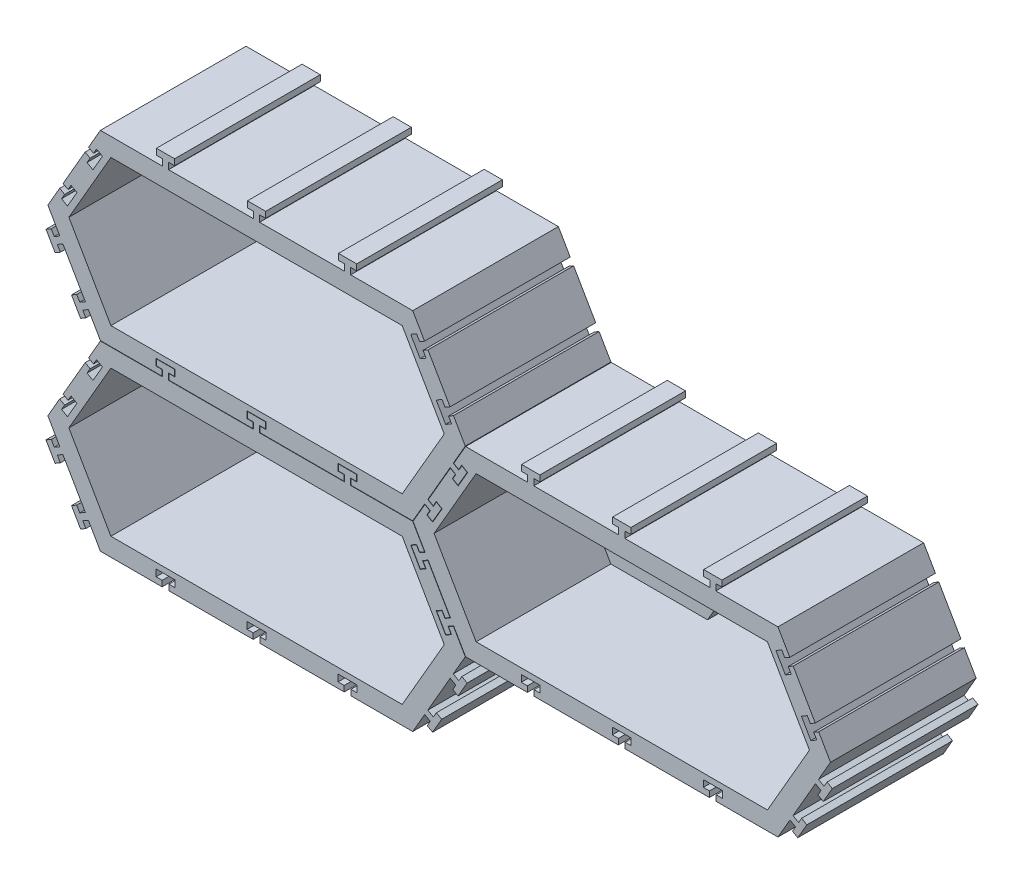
SolidWorks part; units mm, degrees
ref_plane "Front Plane" through (0, 0, 0) normal (0, 0, 1) x (1, 0, 0)
ref_plane "Top Plane" through (0, 0, 0) normal (0, 1, 0) x (1, 0, 0)
ref_plane "Right Plane" through (0, 0, 0) normal (1, 0, 0) x (0, 0, -1)
sketch "Sketch1" plane through (0, 0, 0) normal (0, 0, 1) x (1, 0, 0)
  line L0 (-40, 20) -> (40, -20) construction
  line L7 (51.547, 0) -> (40, 20)
  line L8 (40, 20) -> (-40, 20)
  line L9 (-40, 20) -> (-51.547, 0)
  line L10 (-51.547, 0) -> (-40, -20)
  line L11 (-40, -20) -> (40, -20)
  line L12 (40, -20) -> (51.547, 0)
extrude "Extrude-Thin1" add sketch "Sketch1" along normal blind 40 thin
sketch "Sketch2" plane through (0, 0, 0) normal (0, 0, 1) x (1, 0, 0)
  line L0 (-25, 25) -> (-25, 27.6)
  line L1 (42.8868, 25) -> (-42.8868, 25) construction
  line L2 (-27.5, 27.6) -> (-22.5, 27.6)
  line L3 (-53.6036, -6.4378) -> (-55.8553, -7.7378)
  line L4 (-57.3205, 0) -> (-42.8868, -25) construction
  line L5 (-50.1036, -12.5) -> (-52.3553, -13.8) construction
  line L6 (-57.1053, -5.5728) -> (-54.6053, -9.9029)
  line L7 (-47.6053, -22.0272) -> (-50.1053, -17.6971)
  line L8 (-46.6036, -18.5622) -> (-48.8553, -19.8622)
  line L9 (-50.1036, -12.5) -> (-53.6036, -6.4378) construction
  line L10 (0, 25) -> (0, 27.6)
  line L11 (0, 27.6) -> (-2.5, 27.6)
extrude "Extrude-Thin2" add sketch "Sketch2" along normal through all thin
mirror "Mirror1" about plane through (0, 0, 0) normal (1, 0, 0) of "Extrude-Thin2"
sketch "Sketch3" plane through (0, 0, 0) normal (0, 0, 1) x (1, 0, 0)
  line L0 (-25, -25) -> (-25, -22.5)
  line L1 (-42.8868, -25) -> (42.8868, -25) construction
  line L2 (-27.6, -22.5) -> (-22.4, -22.5)
  line L3 (-53.6036, 6.4378) -> (-51.4386, 5.1878)
  line L4 (-42.8868, 25) -> (-57.3205, 0) construction
  line L5 (-52.7386, 2.9362) -> (-50.1386, 7.4395)
  line L6 (-50.1036, 12.5) -> (-47.9386, 11.25) construction
  line L7 (-53.6036, 6.4378) -> (-50.1036, 12.5) construction
  line L8 (-50.1036, -12.5) -> (-53.6036, -6.4378) construction
  line L11 (-25, 25) -> (-25, 27.6) construction
  line L13 (-46.6036, 18.5622) -> (-44.4386, 17.3122)
  line L14 (-43.1386, 19.5638) -> (-45.7386, 15.0605)
  line L15 (0, -25) -> (0, -22.5)
  line L16 (0, -22.5) -> (-2.6, -22.5)
extrude "Cut-Extrude-Thin1" cut sketch "Sketch3" along normal through all thin
mirror "Mirror2" about plane through (0, 0, 0) normal (1, 0, 0) of "Cut-Extrude-Thin1"
pattern_linear "LPattern1" count 2 spacing 50.1 along (0, 1, 0)
sketch "Sketch5" plane through (0, 0, 0) normal (0, 0, 1) x (1, 0, 0)
  line L0 (-57.827, -5.9894) -> (-53.8836, -9.4862) construction
  line L1 (44.9303, 14.5938) -> (43.9469, 20.0305) construction
  point P4 (-55.8553, -7.7378)
  point P9 (44.4386, 17.3122)
pattern_sketch "Sketch-Pattern1"
sketch "Sketch6" plane through (0, 0, 0) normal (0, 0, -1) x (-1, 0, 0)
  line L0 (-140.2939, 45.05) -> (-60.2939, 45.05) construction
  line L1 (-80.5011, 40.05) -> (-89.1614, 25.05)
  line L2 (-89.1614, 25.05) -> (-80.5011, 10.05)
  line L3 (-80.5011, 10.05) -> (-63.1806, 10.05)
  line L4 (-63.1806, 10.05) -> (-54.5204, 25.05)
  line L5 (-54.5204, 25.05) -> (-63.1806, 40.05)
  line L6 (-151.8409, 25.05) -> (-140.2939, 5.05)
  line L7 (-140.2939, 45.05) -> (-151.8409, 25.05)
  line L8 (-60.2939, 45.05) -> (-140.2939, 45.05)
  line L9 (-48.7469, 25.05) -> (-60.2939, 45.05)
  line L10 (-60.2939, 5.05) -> (-48.7469, 25.05)
  line L11 (-140.2939, 5.05) -> (-60.2939, 5.05)
  line L12 (-151.8409, 25.05) -> (-140.2939, 5.05)
  line L13 (-140.2939, 45.05) -> (-151.8409, 25.05)
  line L14 (-60.2939, 45.05) -> (-140.2939, 45.05)
  line L15 (-48.7469, 25.05) -> (-60.2939, 45.05)
  line L16 (-60.2939, 5.05) -> (-48.7469, 25.05)
  line L17 (-140.2939, 5.05) -> (-60.2939, 5.05)
  line L18 (-63.1806, 40.05) -> (-80.5011, 40.05)
  line L19 (-137.4071, 40.05) -> (-146.0674, 25.05)
  line L20 (-146.0674, 25.05) -> (-137.4071, 10.05)
  line L21 (-137.4071, 10.05) -> (-120.0866, 10.05)
  line L22 (-120.0866, 10.05) -> (-111.4263, 25.05)
  line L23 (-111.4263, 25.05) -> (-120.0866, 40.05)
  line L24 (-120.0866, 40.05) -> (-137.4071, 40.05)
  line L25 (-93.5729, 33.409) -> (-86.852, 45.05)
  line L26 (-86.852, 45.05) -> (-93.5729, 56.691)
  line L27 (-93.5729, 56.691) -> (-107.0148, 56.691)
  line L28 (-107.0148, 56.691) -> (-113.7357, 45.05)
  line L29 (-113.7357, 45.05) -> (-107.0148, 33.409)
  line L30 (-107.0148, 33.409) -> (-93.5729, 33.409)
  line L31 (-93.5729, 16.691) -> (-107.0148, 16.691)
  line L32 (-107.0148, 16.691) -> (-113.7357, 5.05)
  line L33 (-113.7357, 5.05) -> (-107.0148, -6.591)
  line L34 (-107.0148, -6.591) -> (-93.5729, -6.591)
  line L35 (-93.5729, -6.591) -> (-86.852, 5.05)
  line L36 (-86.852, 5.05) -> (-93.5729, 16.691)
  line L37 (-60.2939, 5.05) -> (-140.2939, 5.05) construction
  circle A0 centre (-100.2939, 25.05) radius 2
  circle A1 centre (-71.8409, 25.05) radius 15 construction
  circle A2 centre (-128.7469, 25.05) radius 15 construction
  circle A3 centre (-100.2939, 45.05) radius 11.641 construction
  circle A4 centre (-100.2939, 5.05) radius 11.641 construction
  point P8 (-100.2939, 45.05)
extrude "Boss-Extrude1" add sketch "Sketch6" against normal blind 3 contours L36 L17 L16 L15 L14 L25 L30 L29 L13 L12 L32 L31 A0 L24 L23 L22 L21 L20 L19 L18 L5 L4 L3 L2 L1
delete or keep bodies "Body-Delete/Keep 1" type delete bodies bodies 129
equation "\"wall\"= 5mm"
equation "\"gap\"= 0.1mm"
equation "\"length\"= 80mm"
equation "\"height\"= 40mm"
equation "\"D2@Sketch1\"=\"length\""
equation "\"D3@Sketch1\"=\"height\""
equation "\"D1@Sketch2\"=\"wall\""
equation "\"D2@Sketch2\"=\"wall\"/2 +\"gap\""
equation "\"D1@Sketch3\"=\"wall\"+\"gap\"*2"
equation "\"D2@Sketch3\"=\"D1@Sketch3\"/2"
equation "\"D3@LPattern1\"=\"wall\"*2 + \"height\" + \"gap\""
equation "\"D5@Sketch2\"=\"D1@Sketch2\"/2"
equation "\"D5@Extrude-Thin2\"=\"wall\"/3"
equation "\"D5@Cut-Extrude-Thin1\"=\"wall\"/3 +\"gap\"*2"
equation "\"D3@Sketch3\"=\"wall\"/2"
equation "\"D5@Sketch6\"=\"D3@Sketch6\""
equation "\"D4@Sketch6\"=\"D3@Sketch6\""
equation "\"D6@Sketch6\"=\"D3@Sketch6\""
equation "\"wall\"= 1.62mm"
